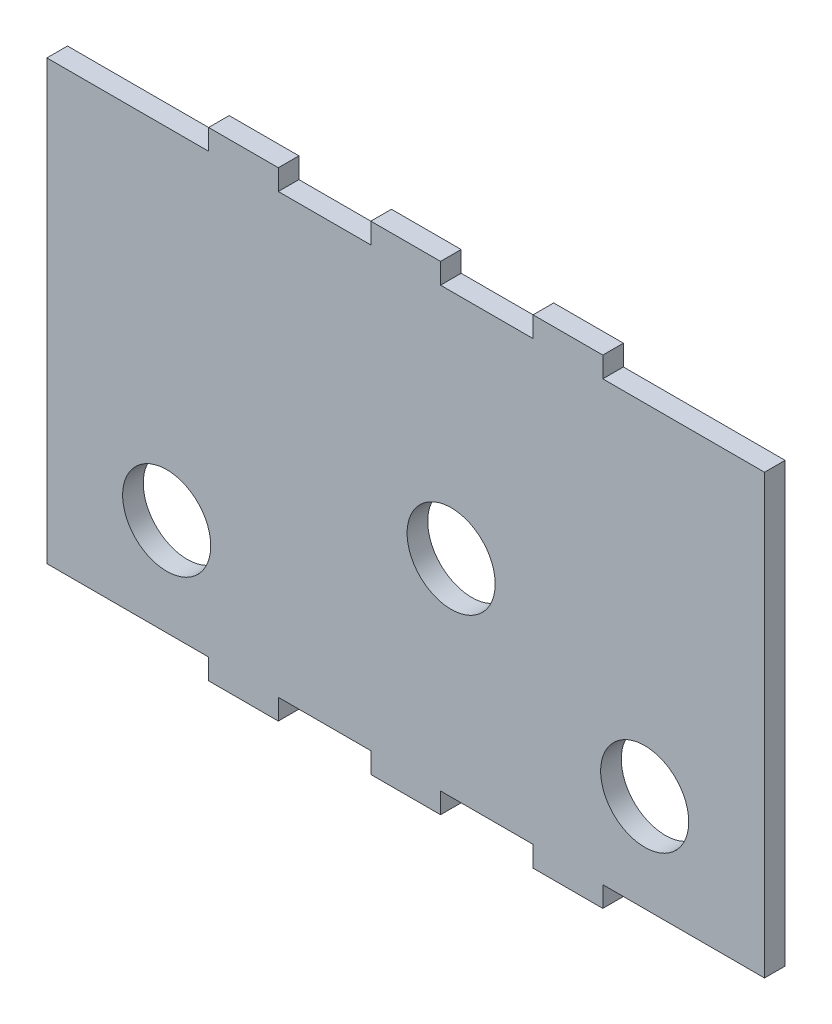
SolidWorks part; units mm, degrees
ref_plane "Front Plane" through (0, 0, 0) normal (0, 0, 1) x (1, 0, 0)
ref_plane "Top Plane" through (0, 0, 0) normal (0, 1, 0) x (1, 0, 0)
ref_plane "Right Plane" through (0, 0, 0) normal (1, 0, 0) x (0, 0, -1)
sketch "Sketch1" plane through (0, 0, 0) normal (0, 0, 1) x (1, 0, 0)
  line L0 (36.9225, 30) -> (184.2425, 30) construction
  line L5 (124.5889, 30) -> (184.2425, 30) construction
  line L6 (124.5889, 63.6704) -> (124.5889, 30) construction
  line L7 (124.5889, 30) -> (36.9225, 30) construction
  line L8 (23.3475, 0) -> (23.3475, 135) construction
  line L9 (0, 94.1504) -> (221.165, 94.1504) construction
  line L10 (197.8175, 0) -> (197.8175, 135) construction
  line L11 (110.5825, 30) -> (110.5825, 0) construction
  line L12 (99.84, 0) -> (99.84, -6.35)
  line L13 (0, 0) -> (221.165, 0) construction
  line L14 (0, 0) -> (0, 135)
  line L15 (0, 135) -> (221.165, 135) construction
  line L16 (221.165, 0) -> (221.165, 135)
  line L17 (99.84, -6.35) -> (121.325, -6.35)
  line L18 (121.325, -6.35) -> (121.325, 0)
  line L19 (99.84, 0) -> (71.325, 0)
  line L20 (71.325, 0) -> (71.325, -6.35)
  line L21 (71.325, -6.35) -> (49.84, -6.35)
  line L22 (49.84, -6.35) -> (49.84, 0)
  line L23 (49.84, 0) -> (0, 0)
  line L24 (121.325, 0) -> (149.84, 0)
  line L25 (149.84, 0) -> (149.84, -6.35)
  line L26 (149.84, -6.35) -> (171.325, -6.35)
  line L27 (171.325, -6.35) -> (171.325, 0)
  line L28 (171.325, 0) -> (221.165, 0)
  line L29 (0, 67.5) -> (221.165, 67.5) construction
  line L30 (171.325, 135) -> (221.165, 135)
  line L31 (171.325, 141.35) -> (171.325, 135)
  line L32 (149.84, 141.35) -> (171.325, 141.35)
  line L33 (149.84, 135) -> (149.84, 141.35)
  line L34 (121.325, 135) -> (149.84, 135)
  line L35 (121.325, 141.35) -> (121.325, 135)
  line L36 (99.84, 141.35) -> (121.325, 141.35)
  line L37 (99.84, 135) -> (99.84, 141.35)
  line L38 (99.84, 135) -> (71.325, 135)
  line L39 (71.325, 135) -> (71.325, 141.35)
  line L40 (71.325, 141.35) -> (49.84, 141.35)
  line L41 (49.84, 141.35) -> (49.84, 135)
  line L42 (49.84, 135) -> (0, 135)
  circle A0 centre (36.9225, 30) radius 13.575
  circle A1 centre (184.2425, 30) radius 13.575
  circle A2 centre (124.5889, 63.6704) radius 13.575
  circle A3 centre (124.5889, 63.6704) radius 30.48 construction
  point P29 (110.5825, -6.35)
  dimension "D2" = 27.15
  dimension "D3" = 93.91
  dimension "D4" = 60.96
  dimension "D9" = 135
  dimension "D10" = 21.485
  dimension "D1" = 68.5
  dimension "D5" = 49.84
  dimension "D6" = 30
  dimension "D7" = 147.32
  dimension "D8" = 49.84
  dimension "D11" = 28.515
  dimension "D12" = 6.35
  dimension "D13" = 147.7
  dimension "D14" = 221.165
extrude "Boss-Extrude1" add sketch "Sketch1" along normal blind 6.35
